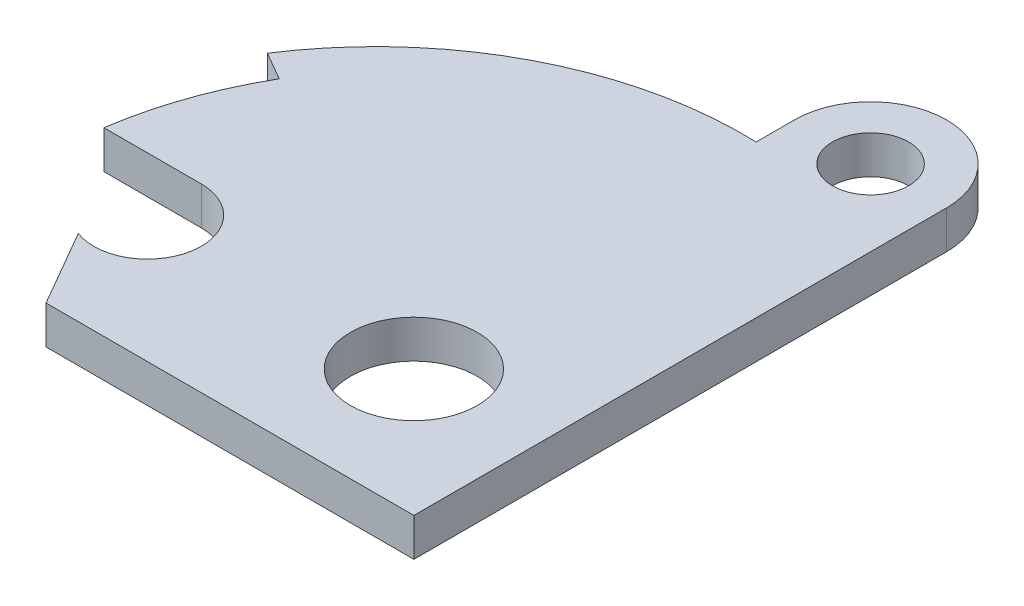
SolidWorks part; units mm, degrees
ref_plane "Front" through (0, 0, 0) normal (0, 0, 1) x (1, 0, 0)
ref_plane "Top" through (0, 0, 0) normal (0, 1, 0) x (1, 0, 0)
ref_plane "Right" through (0, 0, 0) normal (1, 0, 0) x (0, 0, -1)
sketch "Sketch1" plane through (0, 0, 0) normal (0, 1, 0) x (1, 0, 0)
  line L0 (0, 0) -> (0, 42)
  line L1 (0, 0) -> (-29, 0)
  line L4 (-12, 38.9828) -> (-12, 42)
  line L5 (-35.1147, 24.5) -> (-37.3311, 25.7796)
  line L6 (-29, 0) -> (-32.4715, 6.0129)
  line L10 (-31, 14.25) -> (-38.6869, 14.25)
  circle A0 centre (-6, 42) radius 3
  circle A2 centre (-10, 10) radius 5
  arc A3 (-32.4715, 6.0129) -> (-31, 14.25) centre (-31, 10) ccw
  arc A4 (-12, 38.9828) -> (-37.3311, 25.7796) centre (-13, 10) ccw
  arc A5 (-35.1147, 24.5) -> (-38.6869, 14.25) centre (-10, 10) ccw
  arc A8 (0, 42) -> (-12, 42) centre (-6, 42) ccw
  dimension "D1" = 10
  dimension "D2" = 10
  dimension "D3" = 32
  dimension "D4" = 6
  dimension "D5" = 6
  dimension "D6" = 10
  dimension "D8" = 4.25
  dimension "D9" = 29
  dimension "D10" = 29
  dimension "D13" = 21
  dimension "D14" = 10
  dimension "D7" = 60
  dimension "D11" = 3
  dimension "D12" = 19
  dimension "D15" = 10
extrude "Extrude1" add sketch "Sketch1" along normal blind 3
